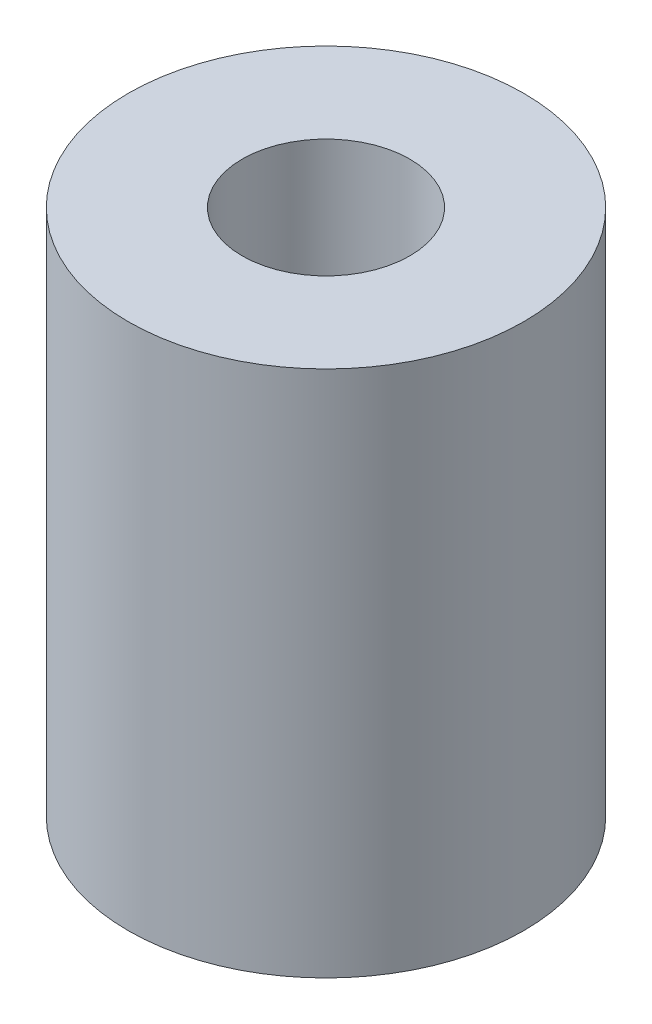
SolidWorks part; units mm, degrees
ref_plane "Front" through (0, 0, 0) normal (0, 0, 1) x (1, 0, 0)
ref_plane "Top" through (0, 0, 0) normal (0, 1, 0) x (1, 0, 0)
ref_plane "Right" through (0, 0, 0) normal (1, 0, 0) x (0, 0, -1)
sketch "Sketch1" plane through (0, 0, 0) normal (0, 1, 0) x (1, 0, 0)
  circle A0 centre (0, 0) radius 4.7625
  dimension "D1" = 9.525
extrude "Boss-Extrude1" add sketch "Sketch1" along normal blind 12.7
sketch "Sketch2" plane through (0, 12.7, 0) normal (0, 1, 0) x (1, 0, 0)
  circle A0 centre (0, 0) radius 2.0193
  point P0 (0, 0)
  dimension "D1" = 4.0386
extrude "Cut-Extrude1" cut sketch "Sketch2" against normal through all
